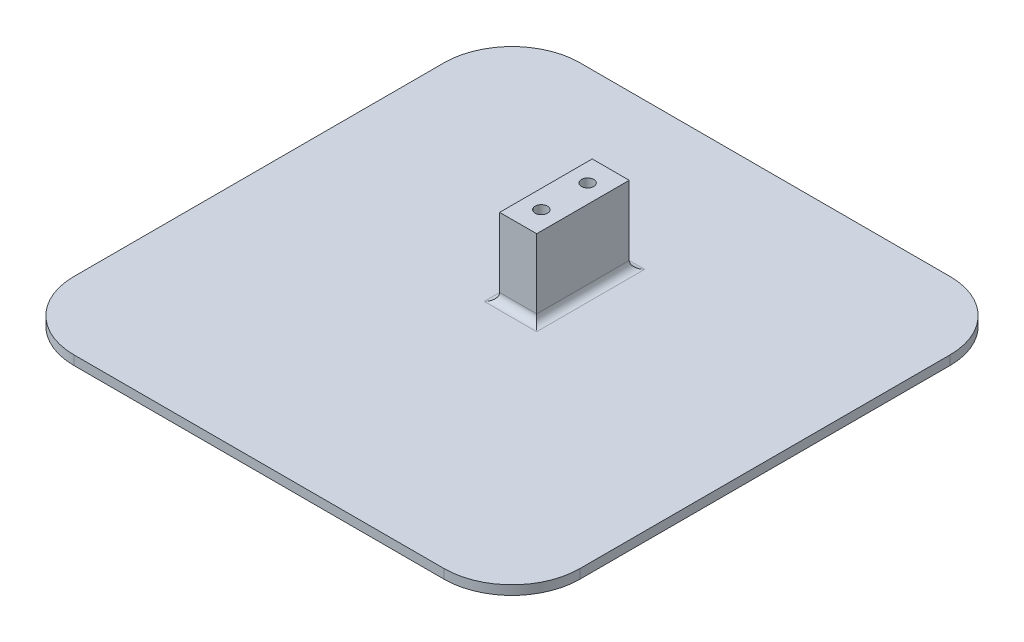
SolidWorks part; units mm, degrees
other "<壳子>-<切除-拉伸30>"
ref_plane "前视基准面" through (0, 0, 0) normal (0, 0, 1) x (1, 0, 0)
ref_plane "上视基准面" through (0, 0, 0) normal (0, 1, 0) x (1, 0, 0)
ref_plane "右视基准面" through (0, 0, 0) normal (1, 0, 0) x (0, 0, -1)
inserted part "壳子"
sketch "草图2" plane through (0, 145, 0) normal (0, 1, 0) x (1, 0, 0)
  line L0 (-85, -60) -> (-85, 60) construction
  line L1 (-32.5, -85) -> (-60, -85) construction
  line L2 (12.5, -85) -> (60, -85) construction
  line L3 (85, -60) -> (85, 60) construction
  line L4 (60, 85) -> (6, 85) construction
  line L5 (-6, 85) -> (-60, 85) construction
  line L6 (-85, -60) -> (-85, 60) construction
  line L7 (-32.5, -85) -> (-60, -85) construction
  line L8 (12.5, -85) -> (60, -85) construction
  line L9 (85, -60) -> (85, 60) construction
  line L10 (60, 85) -> (6, 85) construction
  line L11 (-6, 85) -> (-60, 85) construction
  line L12 (-60, 85) -> (60, 85) construction
  line L13 (85, 60) -> (85, -60) construction
  line L14 (60, -85) -> (-60, -85) construction
  line L15 (-85, 60) -> (-85, -60) construction
  line L16 (-82, 60) -> (-82, -60)
  line L17 (60, -82) -> (-60, -82)
  line L18 (82, 60) -> (82, -60)
  line L19 (-60, 82) -> (60, 82)
  arc A0 (-85, -60) -> (-60, -85) centre (-60, -60) ccw construction
  arc A1 (60, -85) -> (85, -60) centre (60, -60) ccw construction
  arc A2 (85, 60) -> (60, 85) centre (60, 60) ccw construction
  arc A3 (-60, 85) -> (-85, 60) centre (-60, 60) ccw construction
  arc A4 (-85, -60) -> (-60, -85) centre (-60, -60) ccw construction
  arc A5 (60, -85) -> (85, -60) centre (60, -60) ccw construction
  arc A6 (85, 60) -> (60, 85) centre (60, 60) ccw construction
  arc A7 (-60, 85) -> (-85, 60) centre (-60, 60) ccw construction
  arc A8 (-60, 82) -> (-82, 60) centre (-60, 60) ccw
  arc A9 (-82, -60) -> (-60, -82) centre (-60, -60) ccw
  arc A10 (60, -82) -> (82, -60) centre (60, -60) ccw
  arc A11 (82, 60) -> (60, 82) centre (60, 60) ccw
  dimension "D1" = 3
extrude "凸台-拉伸1" add sketch "草图2" along normal blind 3
sketch "草图4" plane through (0, 148, 0) normal (0, 1, 0) x (1, 0, 0)
  line L0 (0, -975.5) -> (0, 49024.5) construction
  circle A0 centre (0, 24.5) radius 2
  circle A1 centre (0, 9.5) radius 2
  circle A2 centre (0, 64.5) radius 2.75 construction
  dimension "D1" = 4
  dimension "D2" = 40
  dimension "D3" = 15
sketch "草图5" plane through (0, 148, 0) normal (0, 1, 0) x (1, 0, 0)
  line L0 (0, 24.5) -> (0, 9.5) construction
  line L1 (-6, 32) -> (6, 32)
  line L2 (-6, 32) -> (-6, 2)
  line L3 (-6, 2) -> (6, 2)
  line L4 (6, 32) -> (6, 2)
  line L5 (-6, 32) -> (6, 2) construction
  line L6 (-6, 2) -> (6, 32) construction
  point P0 (0, 17)
  dimension "D1" = 12
  dimension "D2" = 30
extrude "凸台-拉伸2" add sketch "草图5" along normal blind 25
extrude "切除-拉伸2" cut sketch "草图4" along normal up to next
sketch "草图6" plane through (0, 145, 0) normal (0, 1, 0) x (1, 0, 0)
  line L1 (-126.6049, 103.6622) -> (126.6049, 103.6622)
  line L2 (-126.6049, 103.6622) -> (-126.6049, -103.6622)
  line L3 (-126.6049, -103.6622) -> (126.6049, -103.6622)
  line L4 (126.6049, 103.6622) -> (126.6049, -103.6622)
  line L5 (-126.6049, 103.6622) -> (126.6049, -103.6622) construction
  line L6 (-126.6049, -103.6622) -> (126.6049, 103.6622) construction
  point P0 (0, 0)
extrude "切除-拉伸3" cut sketch "草图6" against normal blind 234
sketch "草图7" plane through (0, 145, 0) normal (0, -1, 0) x (1, 0, 0)
  circle A0 centre (0, -9.5) radius 4.25
  circle A1 centre (0, -24.5) radius 4.25
  dimension "D1" = 8.5
extrude "切除-拉伸4" cut sketch "草图7" against normal blind 5
fillet "圆角1" radius 2.5 4 edges at (0, 148, -32) (0, 148, -2) (6, 148, -17) (-6, 148, -17)
